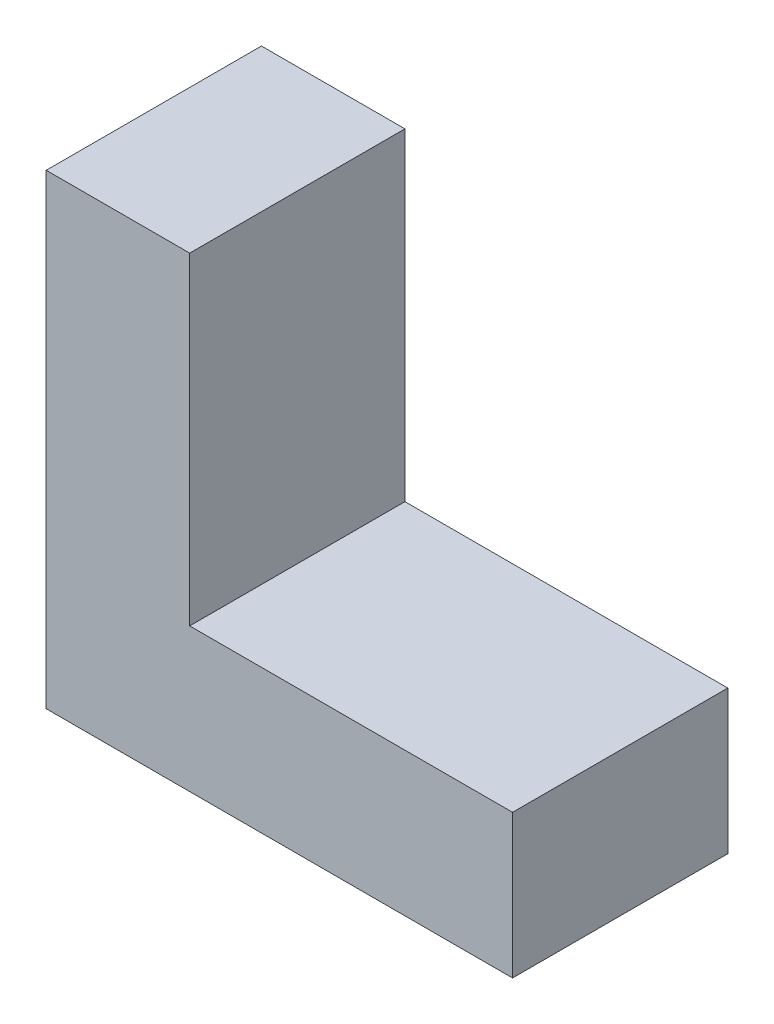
SolidWorks part; units mm, degrees
ref_plane "Face" through (0, 0, 0) normal (0, 0, 1) x (1, 0, 0)
ref_plane "Dessus" through (0, 0, 0) normal (0, 1, 0) x (1, 0, 0)
ref_plane "Droite" through (0, 0, 0) normal (1, 0, 0) x (0, 0, -1)
sketch "Esquisse1" plane through (0, 0, 0) normal (0, 0, 1) x (1, 0, 0)
  line L0 (0, 0) -> (13, 0)
  line L1 (13, 0) -> (13, 4)
  line L2 (13, 4) -> (4, 4)
  line L3 (4, 4) -> (4, 13)
  line L4 (4, 13) -> (0, 13)
  line L5 (0, 13) -> (0, 0)
  dimension "D1" = 13
  dimension "D2" = 13
  dimension "D3" = 4
  dimension "D4" = 4
extrude "Extrusion1" add sketch "Esquisse1" along normal blind 6
